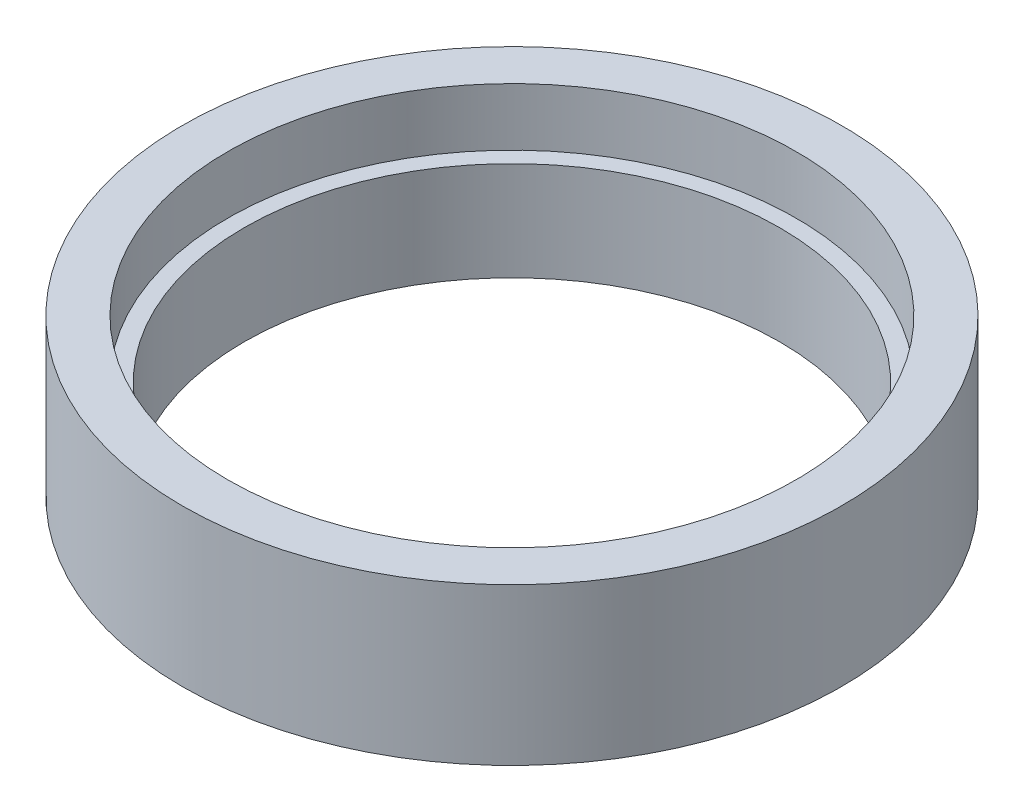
SolidWorks part; units mm, degrees
ref_plane "Alzado" through (0, 0, 0) normal (0, 0, 1) x (1, 0, 0)
ref_plane "Planta" through (0, 0, 0) normal (0, 1, 0) x (1, 0, 0)
ref_plane "Vista lateral" through (0, 0, 0) normal (1, 0, 0) x (0, 0, -1)
sketch "Croquis1" plane through (0, 0, 0) normal (0, 1, 0) x (1, 0, 0)
  circle A0 centre (0, 0) radius 40
extrude "Saliente-Extruir1" add sketch "Croquis1" along normal blind 19
sketch "Croquis2" plane through (0, 19, 0) normal (0, 1, 0) x (1, 0, 0)
  circle A0 centre (0, 0) radius 32.5
extrude "Cortar-Extruir1" cut sketch "Croquis2" against normal blind 19
sketch "Croquis3" plane through (0, 19, 0) normal (0, 1, 0) x (1, 0, 0)
  circle A0 centre (0, 0) radius 34.5
extrude "Cortar-Extruir2" cut sketch "Croquis3" against normal blind 7
